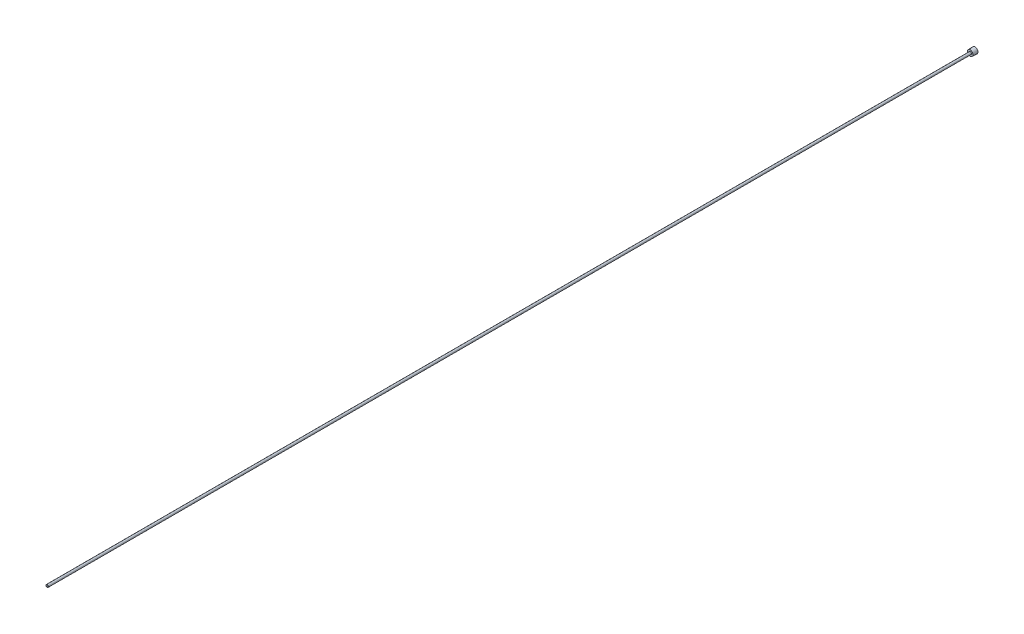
SolidWorks part; units mm, degrees
ref_plane "Front Plane" through (0, 0, 0) normal (0, 0, 1) x (1, 0, 0)
ref_plane "Top Plane" through (0, 0, 0) normal (0, 1, 0) x (1, 0, 0)
ref_plane "Right Plane" through (0, 0, 0) normal (1, 0, 0) x (0, 0, -1)
sketch "Sketch1" plane through (0, 0, 0) normal (1, 0, 0) x (0, 0, -1)
  line L0 (-1219.2, 0) -> (0, 0)
  line L5 (0, 3.8989) -> (-6.35, 3.6674)
  line L6 (0, 0) -> (0, 3.8989)
  line L7 (-6.35, 3.6674) -> (-6.35, 1.5875)
  line L8 (-6.35, 1.5875) -> (-1219.2, 1.5875)
  line L9 (-1219.2, 1.5875) -> (-1219.2, 0)
  line L10 (0, 0) -> (49989.3417, 0) construction
  dimension "D1" = 2.088
  dimension "D2" = 6.35
  dimension "D3" = 1219.2
  dimension "D4" = 3.175
  dimension "D5" = 7.7978
revolve "Revolve1" add sketch "Sketch1" angle 360 about L10
sketch "Sketch2" plane through (0, 0, 1219.2) normal (0, 0, 1) x (1, 0, 0)
  circle A0 centre (0, 0) radius 1.3843
  dimension "D1" = 2.7686
extrude "Cut-Extrude1" cut sketch "Sketch2" against normal through all
sketch "Sketch3" plane through (0, 0, 0) normal (0, 0, -1) x (-1, 0, 0)
  line L0 (0, 4.2888) -> (0, -4.2888) construction
  line L1 (2.3812, -1.3748) -> (2.3812, 1.3748)
  line L2 (2.3812, 1.3748) -> (0, 2.7496)
  line L3 (0, 2.7496) -> (-2.3812, 1.3748)
  line L4 (-2.3812, 1.3748) -> (-2.3812, -1.3748)
  line L5 (-2.3812, -1.3748) -> (0, -2.7496)
  line L6 (0, -2.7496) -> (2.3812, -1.3748)
  circle A0 centre (0, 0) radius 2.3812 construction
  dimension "D1" = 4.7625
extrude "Cut-Extrude2" cut sketch "Sketch3" against normal blind 3.9688
